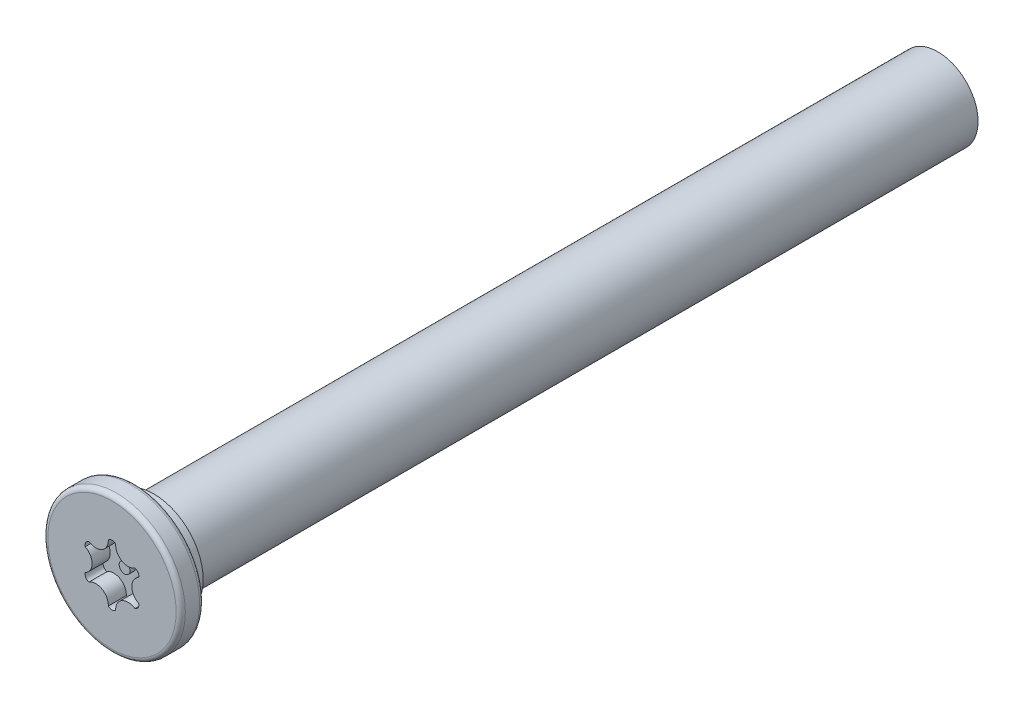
SolidWorks part; units mm, degrees
ref_plane "Front Plane" through (0, 0, 0) normal (0, 0, 1) x (1, 0, 0)
ref_plane "Top Plane" through (0, 0, 0) normal (0, 1, 0) x (1, 0, 0)
ref_plane "Right Plane" through (0, 0, 0) normal (1, 0, 0) x (0, 0, -1)
sketch "Sketch2" plane through (0, 0, 0) normal (1, 0, 0) x (0, 0, -1)
  line L1 (0, 0) -> (1.3, 0)
  line L2 (0, 0) -> (0, 3.81)
  line L3 (0, 3.81) -> (1.3, 3.81)
  line L4 (1.3, 0) -> (1.3, 3.81)
  line L5 (1.3, 0) -> (14, 0)
  line L6 (1.3, 0) -> (1.3, 2.23)
  line L7 (1.3, 2.23) -> (14, 2.23)
  line L8 (14, 0) -> (14, 2.23)
  dimension "D1" = 3.81
  dimension "D2" = 1.3
  dimension "D3" = 12.7
  dimension "D4" = 2.23
revolve "Revolve1" add sketch "Sketch2" angle 360 about L5
sketch "Sketch3" plane through (0, 0, 0) normal (0, 0, 1) x (1, 0, 0)
  line L0 (0, 1.3843) -> (0, 0)
  line L3 (1.1845, -1.0048) -> (2.4257, -1.0048)
  line L4 (0, 1.675) -> (0, 1.6727)
  line L5 (0, 1.675) -> (0, 1.6727)
  line L6 (0, 1.6727) -> (0, 1.675)
  line L8 (1.0407, 1.8026) -> (1.1012, 1.9073)
  line L9 (1.3857, 1.205) -> (2.5818, 1.205)
  line L10 (0, 0) -> (0.8375, 1.4506)
  line L11 (0, 0) -> (2.5818, 0)
  line L14 (2.5818, 0) -> (2.5818, 1.205)
  line L15 (1.3857, 1.205) -> (-0.1691, 1.205)
  circle A0 centre (0, 0) radius 1.675
  arc A7 (1.1845, -1.0048) -> (1.0345, -1.0748) centre (0.8546, -0.4934) cw
  arc A16 (-0.2051, 1.5894) -> (0.2051, 1.5894) centre (0, 1.3843) cw
  arc A18 (0.2051, 1.5894) -> (1.2739, 0.9723) centre (0.8938, 1.5482) ccw
  arc A19 (1.479, 0.6171) -> (1.479, -0.6171) centre (1.7877, 0) ccw
  arc A20 (1.2739, 0.9723) -> (1.479, 0.6171) centre (1.1988, 0.6922) cw
  arc A21 (1.2739, -0.9723) -> (0.2051, -1.5894) centre (0.8938, -1.5482) ccw
  arc A22 (1.479, -0.6171) -> (1.2739, -0.9723) centre (1.1988, -0.6922) cw
  arc A23 (-0.2051, -1.5894) -> (-1.2739, -0.9723) centre (-0.8938, -1.5482) ccw
  arc A24 (0.2051, -1.5894) -> (-0.2051, -1.5894) centre (0, -1.3843) cw
  arc A25 (-1.479, -0.6171) -> (-1.479, 0.6171) centre (-1.7877, 0) ccw
  arc A26 (-1.2739, -0.9723) -> (-1.479, -0.6171) centre (-1.1988, -0.6922) cw
  arc A27 (-1.2739, 0.9723) -> (-0.2051, 1.5894) centre (-0.8938, 1.5482) ccw
  arc A28 (-1.479, 0.6171) -> (-1.2739, 0.9723) centre (-1.1988, 0.6922) cw
  point P38 (0, 0)
  point P52 (0, 0)
  dimension "D1" = 3.35
  dimension "D4" = 1.205
  dimension "D2" = 6
  dimension "D5" = 60
extrude "Cut-Extrude3" cut sketch "Sketch3" against normal blind 1
fillet "Fillet12" radius 0.254 2 edges at (3.81, 0, 0) (3.81, 0, -1.3)
sketch "Sketch7" plane through (0, 0, -14) normal (0, 0, -1) x (-1, 0, 0)
  circle A0 centre (0, 0) radius 2.23
  dimension "D1" = 4.46
extrude "Cut-Extrude6" cut sketch "Sketch7" against normal blind 12.7
sketch "Sketch11" plane through (0, 0, -1.3) normal (0, 0, -1) x (-1, 0, 0)
  circle A0 centre (0, 0) radius 2.23
  circle A1 centre (0, 0) radius 2.738
extrude "Boss-Extrude1" add sketch "Sketch11" along normal blind 1.016
sketch "Sketch12" plane through (0, 0, -1.3) normal (0, 0, -1) x (-1, 0, 0)
  circle A0 centre (0, 0) radius 2.23
extrude "Boss-Extrude2" add sketch "Sketch12" along normal blind 12.7
sketch "Sketch14" plane through (0, 0, -1) normal (0, 0, 1) x (1, 0, 0)
  circle A0 centre (0, 0) radius 0.3
extrude "Boss-Extrude4" add sketch "Sketch14" along normal blind 0.3
sketch "Sketch15" plane through (0, 0, -14) normal (0, 0, -1) x (-1, 0, 0)
  circle A0 centre (0, 0) radius 2.23
extrude "Cut-Extrude7" cut sketch "Sketch15" against normal blind 12.7
sketch "Sketch16" plane through (0, 0, -1.3) normal (0, 0, -1) x (-1, 0, 0)
  circle A0 centre (0, 0) radius 2.23
extrude "Boss-Extrude5" add sketch "Sketch16" along normal blind 44.45
